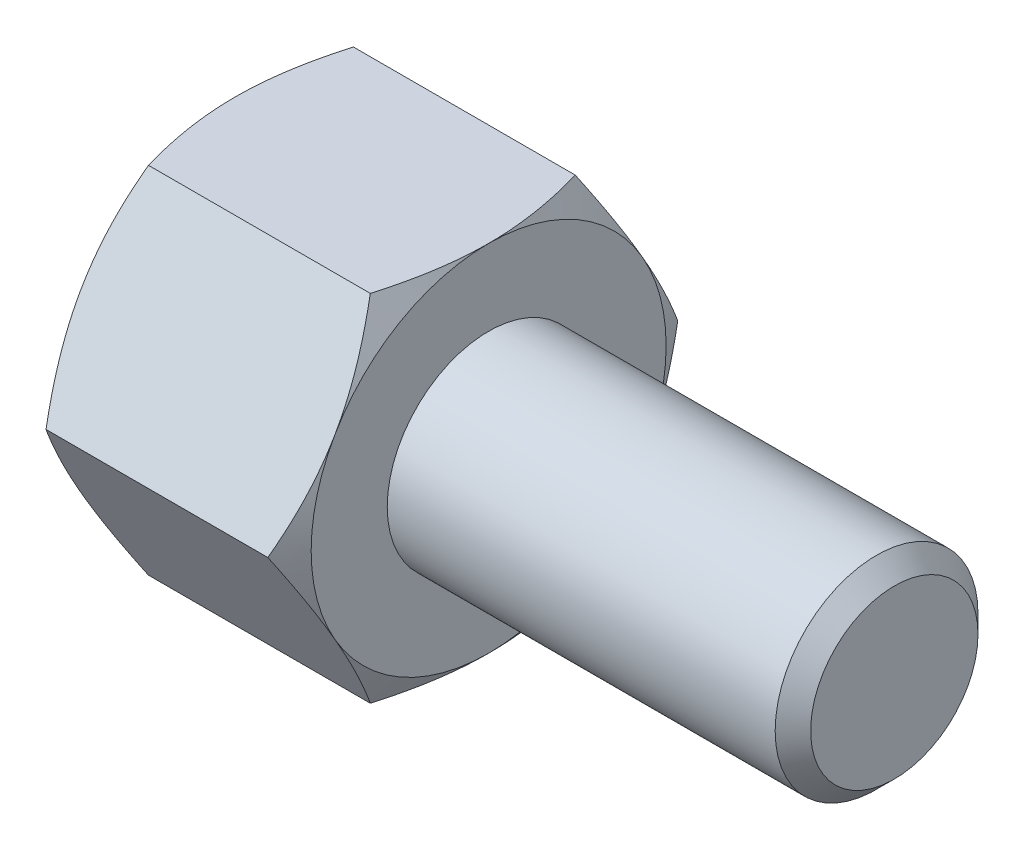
SolidWorks part; units mm, degrees
ref_plane "Front Plane" through (0, 0, 0) normal (0, 0, 1) x (1, 0, 0)
ref_plane "Top Plane" through (0, 0, 0) normal (0, 1, 0) x (1, 0, 0)
ref_plane "Right Plane" through (0, 0, 0) normal (1, 0, 0) x (0, 0, -1)
sketch "Sketch1" plane through (0, 0, 0) normal (1, 0, 0) x (0, 0, -1)
  line L1 (2.0207, 3.5) -> (-2.0207, 3.5)
  line L2 (-2.0207, 3.5) -> (-4.0415, 0)
  line L3 (-4.0415, 0) -> (-2.0207, -3.5)
  line L4 (-2.0207, -3.5) -> (2.0207, -3.5)
  line L5 (2.0207, -3.5) -> (4.0415, 0)
  line L6 (4.0415, 0) -> (2.0207, 3.5)
  circle A0 centre (0, 0) radius 3.5 construction
  dimension "D1" = 7
extrude "Extrude2" add sketch "Sketch1" along normal mid plane 5
sketch "Sketch2" plane through (0, 0, 0) normal (0, 0, 1) x (1, 0, 0)
  line L0 (-2.5, 3.5) -> (-1, 6.0981)
  line L1 (-2.5, 6.5) -> (-2.5, 3.5)
  line L3 (0, 0) -> (50000, 0) construction
  arc A0 (-1, 6.0981) -> (-2.5, 6.5) centre (-1.6962, 6.5) ccw
  dimension "D1" = 30
  dimension "D2" = 3
revolve "Cut-Revolve1" cut sketch "Sketch2" angle 360 about L3
mirror "Mirror1" about plane through (0, 0, 0) normal (1, 0, 0) of "Cut-Revolve1"
sketch "Sketch3" plane through (-2.5, 0, 0) normal (-1, 0, 0) x (0, 0, 1)
  circle A0 centre (0, 0) radius 1.65
  dimension "D1" = 3.3
extrude "Extrude3" cut sketch "Sketch3" against normal blind 3
sketch "Sketch4" plane through (0, 0, 0) normal (0, 0, 1) x (1, 0, 0)
  line L0 (0.5, 0) -> (0.5, 1.65)
  line L1 (2.1874, 0) -> (-2.1874, 0) construction
  line L2 (0.5, 1.65) -> (1.4526, 0)
  line L3 (1.4526, 0) -> (0.5, 0)
  line L4 (-2.5, 1.75) -> (-2.5, -1.75) construction
  point P4 (-2.5, 0)
  dimension "D1" = 30
  dimension "D2" = 1.65
  dimension "D3" = 3
revolve "Cut-Revolve2" cut sketch "Sketch4" angle 360 about L3
sketch "Sketch5" plane through (2.5, 0, 0) normal (1, 0, 0) x (0, 0, -1)
  circle A0 centre (0, 0) radius 2
  dimension "D1" = 4
extrude "Extrude4" add sketch "Sketch5" along normal blind 8
chamfer "Chamfer1" distance 0.35 angle 45 1 edges at (10.5, 0, -2)
equation "\"D2@Sketch4\" = \"D1@Sketch3\"/2"
